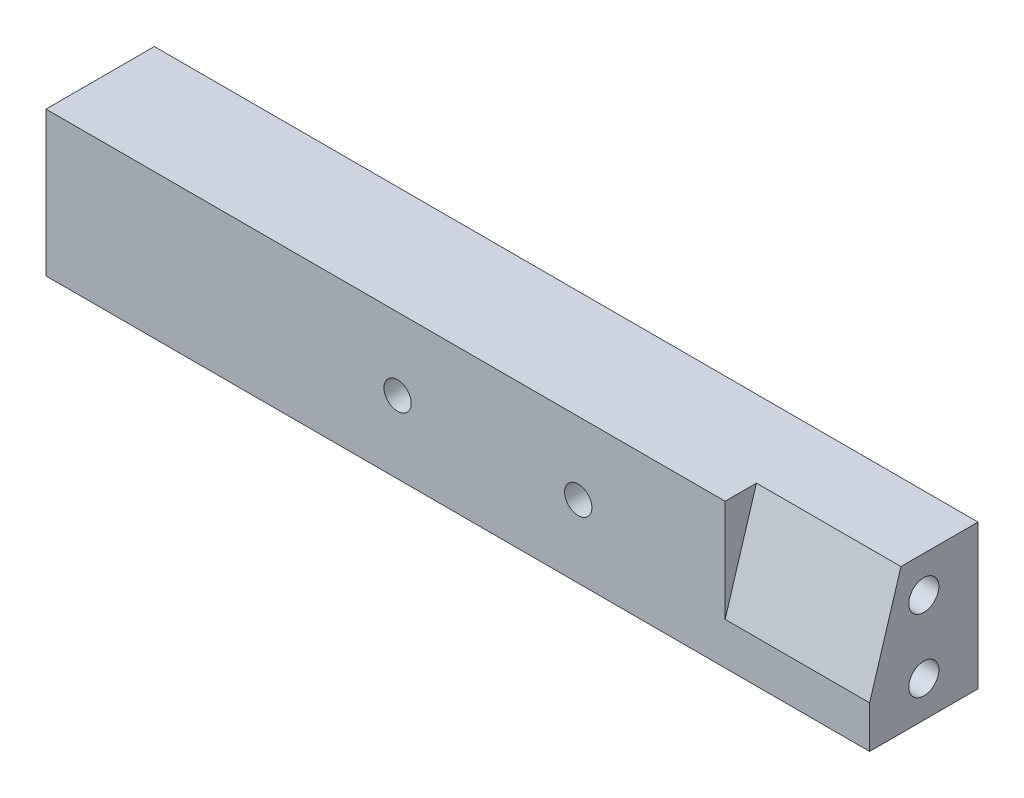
SolidWorks part; units mm, degrees
ref_plane "Plano frontal" through (0, 0, 0) normal (0, 0, 1) x (1, 0, 0)
ref_plane "Plano superior" through (0, 0, 0) normal (0, 1, 0) x (1, 0, 0)
ref_plane "Plano direito" through (0, 0, 0) normal (1, 0, 0) x (0, 0, -1)
sketch "Esboço1" plane through (0, 0, 0) normal (1, 0, 0) x (0, 0, -1)
  line L0 (3.0266, 6) -> (4.5, 6)
  line L1 (-4.5, -6) -> (4.5, -6)
  line L2 (-4.5, -6) -> (-4.5, 6)
  line L3 (-4.5, 6) -> (4.5, 6) construction
  line L4 (4.5, -6) -> (4.5, 6) construction
  line L5 (-4.5, -6) -> (4.5, 6) construction
  line L6 (-4.5, 6) -> (4.5, -6) construction
  line L7 (4.5, 6) -> (4.5, -6)
  line L8 (-4.5, 6) -> (3.0266, 6)
  point P0 (0, 0)
  dimension "D1" = 12
  dimension "D2" = 9
  dimension "D4" = 12.0901
extrude "Ressalto-extrusão1" add sketch "Esboço1" along normal blind 68.4
sketch "Esboço2" plane through (68.4, 0, 0) normal (1, 0, 0) x (0, 0, -1)
  line L0 (-4.5, -2.5) -> (-1.9, 6) construction
  line L1 (-4.5, 6) -> (-4.5, -6) construction
  line L2 (-1.9, 6) -> (-4.5, -2.5)
  line L3 (-4.5, -2.5) -> (-4.5, 6)
  line L4 (-4.5, 6) -> (-4.5, -6)
  line L5 (-4.5, -6) -> (4.5, -6)
  line L6 (4.5, -6) -> (4.5, 6)
  line L7 (4.5, 6) -> (-4.5, 6)
  line L8 (-4.5, 6) -> (-4.5, -6) construction
  line L9 (-4.5, -6) -> (4.5, -6) construction
  line L10 (4.5, -6) -> (4.5, 6)
  line L11 (4.5, 6) -> (-4.5, 6) construction
  line L12 (-4.5, 6) -> (-1.9, 6)
  dimension "D2" = 8.5
  dimension "D3" = 6.4
  dimension "D1" = 0
sketch "Esboço3" plane through (68.4, 0, 0) normal (1, 0, 0) x (0, 0, -1)
  line L1 (4.5, 6) -> (-4.5, 6) construction
  line L2 (-4.5, -6) -> (4.5, -6) construction
  line L3 (0, -6) -> (0, 6) construction
  point P6 (0, 3)
  point P10 (0, -3)
  dimension "D1" = 3
  dimension "D2" = 3
hole_wizard "Furo roscado de M3x0.51" positions "Esboço5" profile "Esboço4" tap size "M3x0.5" standard "Ansi Metric"
sketch "Esboço5" plane through (68.4, 0, 0) normal (1, 0, 0) x (0, 0, -1)
  point P0 (0, -3)
  point P7 (0, 3)
sketch "Esboço4" plane through (68.4, -3, 0) normal (0, 1, 0) x (0, 0, -1)
  line L0 (0, 0) -> (0, 9.2511)
  line L1 (0, 9.2511) -> (1.25, 8.5)
  line L2 (1.25, 8.5) -> (1.25, 0)
  line L5 (1.25, 0) -> (0, 0)
  line L10 (0, 9.2511) -> (-1.25, 8.5) construction
  line L11 (0, -6.35) -> (0, 107.95) construction
  dimension "Tap Drill Dia." = 2.5
  dimension "Tap Drill Depth" = 8.5
  dimension "Drill Angle" = 118
sketch "Esboço6" plane through (0, 0, 0) normal (-1, 0, 0) x (0, 0, 1)
  line L0 (0, -6) -> (0, 6) construction
  line L1 (4.5, -6) -> (-4.5, -6) construction
  line L2 (-4.5, 6) -> (4.5, 6) construction
  point P7 (0, -3)
  point P8 (0, 3)
  dimension "D1" = 3
  dimension "D2" = 3
hole_wizard "Furo roscado de M3x0.52" positions "Esboço8" profile "Esboço7" tap size "M3x0.5" standard "Ansi Metric"
sketch "Esboço8" plane through (0, 0, 0) normal (-1, 0, 0) x (0, 0, 1)
  point P0 (0, 3)
  point P3 (0, -3)
sketch "Esboço7" plane through (0, 3, 0) normal (0, 1, 0) x (0, 0, 1)
  line L0 (0, 0) -> (0, 9.2511)
  line L1 (0, 9.2511) -> (1.25, 8.5)
  line L2 (1.25, 8.5) -> (1.25, 0)
  line L5 (1.25, 0) -> (0, 0)
  line L10 (0, 9.2511) -> (-1.25, 8.5) construction
  line L11 (0, -6.35) -> (0, 107.95) construction
  dimension "Tap Drill Dia." = 2.5
  dimension "Tap Drill Depth" = 8.5
  dimension "Drill Angle" = 118
sketch "Esboço9" plane through (0, -12.5037, -4.5) normal (0, 0, 1) x (-1, 0, 0)
  line L3 (-68.4, -6.5037) -> (0, -6.5037) construction
  line L4 (-68.4, -6.5037) -> (0, -6.5037) construction
  line L5 (0, -6.5037) -> (0, -18.5037) construction
  line L6 (0, -18.5037) -> (-68.4, -18.5037) construction
  line L7 (-68.4, -18.5037) -> (-68.4, -6.5037) construction
  line L8 (-68.4, -6.5037) -> (0, -6.5037) construction
  circle A0 centre (-29.2, -12.5037) radius 1.5 construction
  circle A5 centre (-44.2, -12.5037) radius 1.5 construction
  dimension "D3" = 3
  dimension "D4" = 3
  dimension "D5" = 44.2
  dimension "D6" = 15
  dimension "D7" = 6
hole_wizard "Furo roscado de M3x0.55" positions "3DSketch2" profile "Esboço16" tap size "M3x0.5" standard "Ansi Metric"
sketch3d "3DSketch2"
  point P0 (44.2, 0, -4.5)
  point P3 (29.2, 0, -4.5)
sketch "Esboço16" plane through (44.2, 0, -4.5) normal (1, 0, 0) x (0, 1, 0)
  line L0 (0, 0) -> (0, 9.6811)
  line L1 (0, 9.6811) -> (1.25, 8.93)
  line L2 (1.25, 8.93) -> (1.25, 0)
  line L5 (1.25, 0) -> (0, 0)
  line L10 (0, 9.6811) -> (-1.25, 8.93) construction
  line L11 (0, -6.35) -> (0, 107.95) construction
  dimension "Tap Drill Dia." = 2.5
  dimension "Tap Drill Depth" = 8.93
  dimension "Drill Angle" = 118
extrude "Corte-extrusão1" cut sketch "Esboço2" against normal blind 12 contours L2 M11 M8 M9
